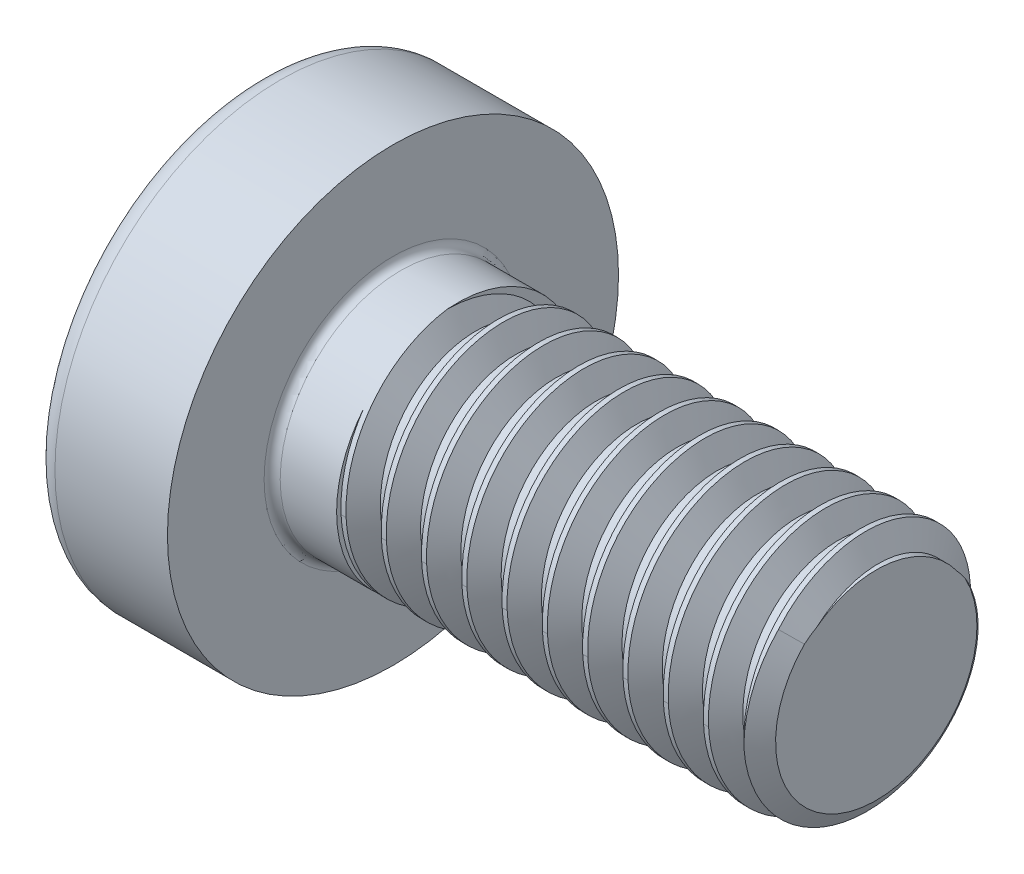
SolidWorks part; units mm, degrees
ref_plane "Front Plane" through (0, 0, 0) normal (0, 0, 1) x (1, 0, 0)
ref_plane "Top Plane" through (0, 0, 0) normal (0, 1, 0) x (1, 0, 0)
ref_plane "Right Plane" through (0, 0, 0) normal (1, 0, 0) x (0, 0, -1)
sketch "Sketch2" plane through (0, 0, 0) normal (0, -1, 0) x (1, 0, 0)
  line L0 (0, 0) -> (-8.4, 0)
  line L1 (0, 0) -> (0, 1.5)
  line L2 (0, 1.5) -> (-6, 1.5)
  line L3 (-6, 1.5) -> (-6, 2.8)
  line L4 (-6, 2.8) -> (-7.3965, 2.8)
  line L5 (-2.352, 0) -> (2.352, 0) construction
  arc A0 (-7.3965, 2.8) -> (-7.6246, 2.6744) centre (-7.3965, 2.53) ccw
  arc A1 (-7.6246, 2.6744) -> (-8.4, 0) centre (-3.4, 0) ccw
  point P17 (0, 0)
  dimension "D1" = 3
  dimension "D4" = 5
  dimension "D5" = 0.27
  dimension "D2" = 5.6
  dimension "D3" = 6
  dimension "D6" = 2.4
revolve "Revolve1" add sketch "Sketch2" angle 360 about L5
fillet "Fillet1" radius 0.1 1 edges at (-6, 0, 1.5)
ref_plane "Plane1" through (-8.4, 0, 0) normal (-1, 0, 0) x (0, 0, 1)
ref_plane "Plane2" through (-6.65, 0, 0) normal (-1, 0, 0) x (0, 0, 1)
sketch "Sketch3" plane through (-8.4, 0, 0) normal (1, 0, 0) x (0, 0, -1)
  line L1 (-0.37, 1.4) -> (0.37, 1.4)
  line L2 (-0.37, 1.4) -> (-0.37, -1.4)
  line L3 (-0.37, -1.4) -> (0.37, -1.4)
  line L4 (0.37, 1.4) -> (0.37, -1.4)
  line L5 (-0.37, 1.4) -> (0.37, -1.4) construction
  line L6 (-0.37, -1.4) -> (0.37, 1.4) construction
  point P0 (0, 0)
  dimension "D1" = 2.8
  dimension "D2" = 0.74
sketch "Sketch4" plane through (-6.65, 0, 0) normal (1, 0, 0) x (0, 0, -1)
  line L1 (0.37, -0.5275) -> (-0.37, -0.5275)
  line L2 (0.37, -0.5275) -> (0.37, 0.5275)
  line L3 (0.37, 0.5275) -> (-0.37, 0.5275)
  line L4 (-0.37, -0.5275) -> (-0.37, 0.5275)
  line L5 (0.37, -0.5275) -> (-0.37, 0.5275) construction
  line L6 (0.37, 0.5275) -> (-0.37, -0.5275) construction
  point P0 (0, 0)
  dimension "D1" = 1.055
  dimension "D2" = 0.74
loft "Cut-Loft1" cut profiles "Sketch3", "Sketch4"
pattern_circular "CirPattern1" count 2 over 90 about axis through (0, 0, 0) along (1, 0, 0) of "Cut-Loft1"
sketch "Sketch5" plane through (0, 0, 0) normal (0, 0, 1) x (1, 0, 0)
  line L0 (-8.4, 0.6784) -> (-8.4, 0)
  line L1 (-8.4, 0) -> (-6.4693, 0)
  line L2 (-6.4693, 0) -> (-6.65, 0.556)
  line L3 (-6.65, 0.556) -> (-8.4, 0.6784)
  line L4 (-8.4, 0) -> (-6, 0) construction
  line L5 (-6, -1.6) -> (-6, 1.6) construction
  dimension "D1" = 0.6784
  dimension "D2" = 1.75
  dimension "D3" = 2.4
  dimension "D4" = 4
  dimension "D5" = 18
revolve "Cut-Revolve1" cut sketch "Sketch5" angle 360 about L4
chamfer "Chamfer1" distance 0.25 angle 30 1 edges at (0, 0, 1.5)
thread "Thread1" pitch 0.5 start angle 0, offset 2, length 0, pitch 0.5, diameter 3
ref_plane "Plane3" through (1.8557, 0, 1.5) normal (0, -1, 0) x (0, 0, 1)
sketch "Thread Profile1" plane through (1.8557, 0, 1.5) normal (0, -1, 0) x (0, 0, 1)
  line L0 (0, 0) -> (0, 0.5) construction
  line L11 (0, 0) -> (0, 0.4375)
  line L12 (0, 0.4375) -> (-0.2706, 0.2812)
  line L13 (-0.2706, 0.2812) -> (-0.2706, 0.1562)
  line L15 (-0.2706, 0.1562) -> (0, 0)
  line L17 (-0.2706, 0.2187) -> (0, 0.2187) construction
  point P2 (0, 0)
  dimension "Pitch" = 0.5
  dimension "Profile_Angle" = 60
  dimension "Profile_Land" = 0.125
  dimension "Profile_Height" = 0.2706
sketch "Sketch8" plane through (-6, 0, 0) normal (1, 0, 0) x (0, 0, -1)
  circle A0 centre (0, 0) radius 1.5
  dimension "D1" = 3
extrude "Boss-Extrude1" add sketch "Sketch8" along normal blind 0.8
